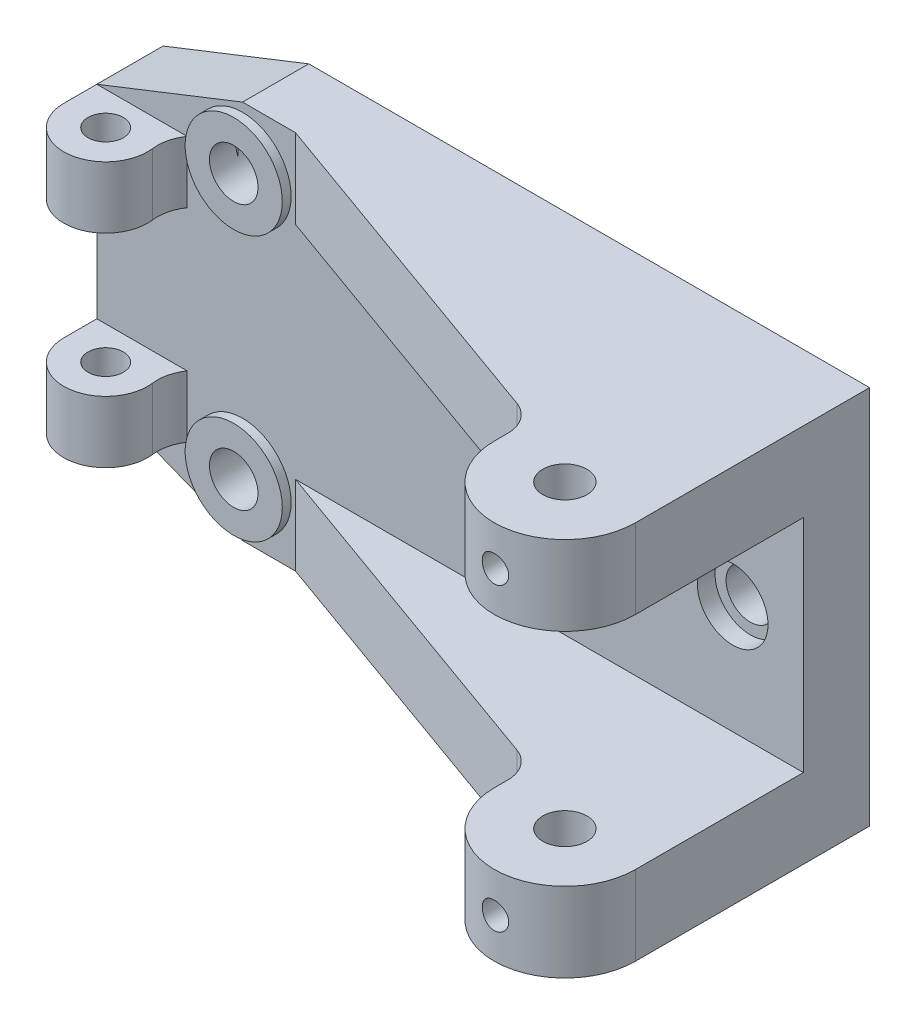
SolidWorks part; units mm, degrees
ref_plane "Plane1" through (0, 0, 0) normal (0, 0, 1) x (1, 0, 0)
ref_plane "Plane2" through (0, 0, 0) normal (0, 1, 0) x (1, 0, 0)
ref_plane "Plane3" through (0, 0, 0) normal (1, 0, 0) x (0, 0, -1)
sketch "Esquisse1" plane through (0, 0, 0) normal (0, 0, 1) x (1, 0, 0)
  line L0 (0, 0) -> (0, 86)
  line L1 (0, 86) -> (-127, 86)
  line L2 (-127, 86) -> (-160, 73)
  line L3 (-160, 73) -> (-160, 13)
  line L4 (-160, 13) -> (-127, 0)
  line L5 (-127, 0) -> (0, 0)
  dimension "D1" = 160
  dimension "D2" = 86
  dimension "D3" = 127
  dimension "D4" = 127
  dimension "D5" = 13
  dimension "D6" = 13
extrude "Base-Extrusion" add sketch "Esquisse1" along normal blind 15
sketch "Esquisse2" plane through (0, 0, 15) normal (0, 0, 1) x (1, 0, 0)
  circle A0 centre (-127, 73) radius 11
  circle A1 centre (-127, 13) radius 11
  dimension "D1" = 22
  dimension "D2" = 22
extrude "Boss.-Extru.1" add sketch "Esquisse2" along normal blind 2
sketch "Esquisse3" plane through (0, 0, 17) normal (0, 0, 1) x (1, 0, 0)
  line L0 (0, 86) -> (-127, 86) construction
  line L1 (0, 0) -> (0, 86) construction
  circle A0 centre (-127, 73) radius 5.5
  circle A1 centre (-127, 13) radius 5.5
  circle A2 centre (-16, 43) radius 5.5
  dimension "D3" = 11
  dimension "D4" = 11
  dimension "D5" = 11
  dimension "D1" = 43
  dimension "D2" = 16
extrude "Enlèv. mat.-Extru.1" cut sketch "Esquisse3" against normal through all
sketch "Esquisse4" plane through (0, 0, 15) normal (0, 0, 1) x (1, 0, 0)
  circle A0 centre (-16, 43) radius 8
  dimension "D1" = 16
extrude "Enlèv. mat.-Extru.2" cut sketch "Esquisse4" against normal blind 4
sketch "Esquisse5" plane through (0, 0, 0) normal (0, 1, 0) x (1, 0, 0)
  line L0 (0, -15) -> (0, -53)
  line L1 (-32, -53) -> (-32, -49.9121)
  line L2 (-115, -15) -> (-36.8655, -43)
  line L3 (-127, -15) -> (0, -15) construction
  line L5 (-115, -15) -> (0, -15)
  arc A0 (0, -53) -> (-32, -53) centre (-16, -53) cw
  arc A1 (-32, -49.9121) -> (-36.8655, -43) centre (-39.3425, -49.9121) ccw
  dimension "D5" = 28
  dimension "D1" = 16
  dimension "D2" = 38
  dimension "D3" = 115
  dimension "D4" = 83
extrude "Boss.-Extru.3" add sketch "Esquisse5" along normal blind 18
pattern_linear "Répétition linéaire1" count 2 spacing 68
sketch "Esquisse7" plane through (0, 0, 0) normal (0, -1, 0) x (1, 0, 0)
  circle A0 centre (-16, 53) radius 5
  dimension "D1" = 10
extrude "Enlèv. mat.-Extru.3" cut sketch "Esquisse7" against normal through all
ref_plane "Plan4" through (0, 13, 0) normal (0, 1, 0) x (-1, 0, 0)
sketch "Esquisse9" plane through (0, 13, 0) normal (0, 1, 0) x (-1, 0, 0)
  line L0 (160, 11) -> (160, 22.5)
  line L1 (160, 15) -> (160, 0) construction
  line L2 (160, 11) -> (132, 11)
  line L3 (160, 0) -> (127, 0) construction
  arc A0 (160, 22.5) -> (141.0758, 21.3023) centre (150.5, 22.5) ccw
  arc A1 (141.0758, 21.3023) -> (132, 11) centre (132, 20.1488) cw
  dimension "D3" = 9.5
  dimension "D1" = 11
  dimension "D2" = 11.5
  dimension "D4" = 28
extrude "Boss.-Extru.6" add sketch "Esquisse9" along normal blind 14
pattern_linear "Répétition linéaire10" count 2 spacing 46
sketch "Esquisse10" plane through (0, 13, 0) normal (0, -1, 0) x (1, 0, 0)
  circle A0 centre (-150.5, 22.5) radius 4
  dimension "D1" = 8
extrude "Enlèv. mat.-Extru.4" cut sketch "Esquisse10" against normal through all
ref_plane "Plan5" through (0, 0, 53) normal (0, 0, 1) x (1, 0, 0)
sketch "Esquisse12" plane through (0, 0, 53) normal (0, 0, 1) x (1, 0, 0)
  line L0 (0, 18) -> (-32, 18) construction
  line L1 (0, 18) -> (0, 68) construction
  line L2 (0, 68) -> (-32, 68) construction
  circle A0 centre (-16, 9) radius 3
  circle A1 centre (-16, 77) radius 3
  dimension "D5" = 6
  dimension "D6" = 6
  dimension "D1" = 16
  dimension "D2" = 16
  dimension "D3" = 9
  dimension "D4" = 9
extrude "Enlèv. mat.-Extru.5" cut sketch "Esquisse12" along normal up to next
